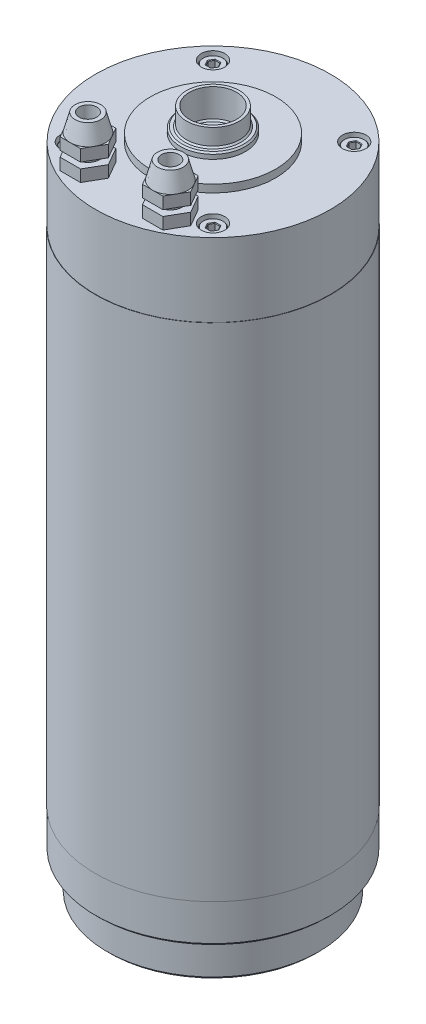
SolidWorks part; units mm, degrees
ref_plane "Ebene vorne" through (0, 0, 0) normal (0, 0, 1) x (1, 0, 0)
ref_plane "Ebene oben" through (0, 0, 0) normal (0, 1, 0) x (1, 0, 0)
ref_plane "Ebene rechts" through (0, 0, 0) normal (1, 0, 0) x (0, 0, -1)
sketch "Skizze1" plane through (0, 0, 0) normal (0, 0, 1) x (1, 0, 0)
  line L0 (-15, 0) -> (0, 0) construction
  line L1 (-15, 0) -> (-35, 0)
  line L2 (0, 30) -> (0, 224)
  line L3 (0, 224) -> (-21.3, 224)
  line L4 (-40, 26) -> (-40, 196.4)
  line L5 (0, 0) -> (0, 30) construction
  line L6 (-21.3, 224) -> (-21.3, 221.4)
  line L7 (-21.3, 221.4) -> (-39.9, 221.4)
  line L8 (-15, 0) -> (-15, 30)
  line L9 (-40, 196.4) -> (-39.9, 196.4)
  line L10 (-39.9, 221.4) -> (-39.9, 196.4)
  line L11 (-40, 26) -> (-39.9, 26)
  line L12 (-39.9, 13.6) -> (-39.9, 26)
  line L13 (-38.9, 12.6) -> (-36, 12.6)
  line L14 (-36, 1) -> (-36, 12.6)
  line L15 (-15, 30) -> (0, 30)
  line L16 (-39.9, 13.6) -> (-38.9, 12.6)
  line L17 (-35, 0) -> (-36, 1)
  point P12 (-39.9, 12.6)
  point P13 (-36, 0)
  dimension "D2" = 2.6
  dimension "D3" = 21.3
  dimension "D4" = 40
  dimension "D5" = 25
  dimension "D6" = 39.9
  dimension "D7" = 26
  dimension "D8" = 39.9
  dimension "D9" = 12.6
  dimension "D10" = 36
  dimension "D11" = 15
  dimension "D12" = 30
  dimension "D13" = 224
revolve "Rotation1" add sketch "Skizze1" angle 360 about L2
sketch "Skizze2" plane through (0, 221.4, 0) normal (0, 1, 0) x (1, 0, 0)
  line L1 (24, -24) -> (-24, -24) construction
  line L2 (24, -24) -> (24, 24) construction
  line L3 (24, 24) -> (-24, 24) construction
  line L4 (-24, -24) -> (-24, 24) construction
  circle A0 centre (24, -24) radius 4
  circle A1 centre (-24, -24) radius 4
  circle A2 centre (-24, 24) radius 4
  circle A3 centre (24, 24) radius 4
  dimension "D5" = 8
  dimension "D6" = 8
  dimension "D7" = 8
  dimension "D8" = 8
  dimension "D1" = 48
  dimension "D2" = 48
  dimension "D3" = 24
  dimension "D4" = 24
extrude "Schnitt-Linear austragen1" cut sketch "Skizze2" against normal blind 6
sketch "Skizze3" plane through (0, 215.4, 0) normal (0, 1, 0) x (1, 0, 0)
  line L0 (24, -24) -> (22.2679, -24) construction
  line L1 (22.2679, -24) -> (23.134, -25.5)
  line L2 (23.134, -25.5) -> (24.866, -25.5)
  line L3 (24.866, -25.5) -> (25.7321, -24)
  line L4 (25.7321, -24) -> (24.866, -22.5)
  line L5 (24.866, -22.5) -> (23.134, -22.5)
  line L6 (23.134, -22.5) -> (22.2679, -24)
  line L7 (-25.7321, -24) -> (-24.866, -25.5)
  line L8 (-24.866, -25.5) -> (-23.134, -25.5)
  line L9 (-23.134, -25.5) -> (-22.2679, -24)
  line L10 (-22.2679, -24) -> (-23.134, -22.5)
  line L11 (-23.134, -22.5) -> (-24.866, -22.5)
  line L12 (-24.866, -22.5) -> (-25.7321, -24)
  line L13 (-25.7321, 24) -> (-24.866, 22.5)
  line L14 (-24.866, 22.5) -> (-23.134, 22.5)
  line L15 (-23.134, 22.5) -> (-22.2679, 24)
  line L16 (-22.2679, 24) -> (-23.134, 25.5)
  line L17 (-23.134, 25.5) -> (-24.866, 25.5)
  line L18 (-24.866, 25.5) -> (-25.7321, 24)
  line L19 (22.2679, 24) -> (23.134, 22.5)
  line L20 (23.134, 22.5) -> (24.866, 22.5)
  line L21 (24.866, 22.5) -> (25.7321, 24)
  line L22 (25.7321, 24) -> (24.866, 25.5)
  line L23 (24.866, 25.5) -> (23.134, 25.5)
  line L24 (23.134, 25.5) -> (22.2679, 24)
  circle A0 centre (24, -24) radius 3.5
  circle A1 centre (24, -24) radius 1.5 construction
  circle A2 centre (-24, -24) radius 1.5 construction
  circle A3 centre (-24, -24) radius 3.5
  circle A4 centre (-24, 24) radius 1.5 construction
  circle A5 centre (-24, 24) radius 3.5
  circle A6 centre (24, 24) radius 1.5 construction
  circle A7 centre (24, 24) radius 3.5
  dimension "D1" = 7
  dimension "D2" = 3
  dimension "D3" = 2
  dimension "D4" = 2
extrude "Aufsatz-Linear austragen1" add sketch "Skizze3" along normal blind 5
chamfer "Fase1" distance 0.2 angle 45 7 edges at (24, 220.4, 25.5) (25.299, 220.4, 24.75) (25.299, 220.4, 23.25) (24, 220.4, 22.5) (22.701, 220.4, 23.25) (22.701, 220.4, 24.75) (20.5, 220.4, 24)
chamfer "Fase2" distance 0.2 angle 45 7 edges at (-24, 220.4, 25.5) (-22.701, 220.4, 24.75) (-22.701, 220.4, 23.25) (-24, 220.4, 22.5) (-25.299, 220.4, 23.25) (-25.299, 220.4, 24.75) (-27.5, 220.4, 24)
chamfer "Fase3" distance 0.2 angle 45 7 edges at (-24, 220.4, -22.5) (-22.701, 220.4, -23.25) (-22.701, 220.4, -24.75) (-24, 220.4, -25.5) (-25.299, 220.4, -24.75) (-25.299, 220.4, -23.25) (-27.5, 220.4, -24)
chamfer "Fase4" distance 0.2 angle 45 7 edges at (24, 220.4, -22.5) (25.299, 220.4, -23.25) (25.299, 220.4, -24.75) (24, 220.4, -25.5) (22.701, 220.4, -24.75) (22.701, 220.4, -23.25) (20.5, 220.4, -24)
sketch "Skizze5" plane through (0, 224, 0) normal (0, 1, 0) x (1, 0, 0)
  circle A0 centre (0, 0) radius 11
  dimension "D1" = 22
extrude "Aufsatz-Linear austragen2" add sketch "Skizze5" along normal blind 8
sketch "Skizze6" plane through (0, 232, 0) normal (0, 1, 0) x (1, 0, 0)
  circle A0 centre (0, 0) radius 9
  circle A1 centre (0, 0) radius 14.4788
  dimension "D1" = 18
extrude "Schnitt-Linear austragen2" cut sketch "Skizze6" against normal blind 6
sketch "Skizze7" plane through (0, 232, 0) normal (0, 1, 0) x (1, 0, 0)
  circle A0 centre (0, 0) radius 8
  dimension "D1" = 16
extrude "Schnitt-Linear austragen3" cut sketch "Skizze7" against normal blind 10
chamfer "Fase5" distance 0.5 angle 45 3 edges at (-8, 222, 0) (-9, 226, 0) (-11, 226, 0)
sketch "Skizze8" plane through (0, 221.4, 0) normal (0, 1, 0) x (1, 0, 0)
  line L0 (14, -28.5) -> (-14, -28.5) construction
  line L2 (10.5359, -22.5) -> (7.0718, -28.5)
  line L3 (7.0718, -28.5) -> (10.5359, -34.5)
  line L4 (10.5359, -34.5) -> (17.4641, -34.5)
  line L5 (17.4641, -34.5) -> (20.9282, -28.5)
  line L6 (20.9282, -28.5) -> (17.4641, -22.5)
  line L7 (17.4641, -22.5) -> (10.5359, -22.5)
  line L8 (-10.5359, -22.5) -> (-17.4641, -22.5)
  line L9 (-17.4641, -22.5) -> (-20.9282, -28.5)
  line L10 (-20.9282, -28.5) -> (-17.4641, -34.5)
  line L11 (-17.4641, -34.5) -> (-10.5359, -34.5)
  line L12 (-10.5359, -34.5) -> (-7.0718, -28.5)
  line L13 (-7.0718, -28.5) -> (-10.5359, -22.5)
  circle A0 centre (14, -28.5) radius 6 construction
  circle A1 centre (-14, -28.5) radius 6 construction
  circle A2 centre (0, 0) radius 39.9 construction
  dimension "D1" = 28
  dimension "D2" = 14
  dimension "D3" = 12
  dimension "D4" = 12
  dimension "D5" = 28.5
extrude "Aufsatz-Linear austragen3" add sketch "Skizze8" along normal blind 4
sketch "Skizze9" plane through (0, 225.4, 0) normal (0, 1, 0) x (1, 0, 0)
  line L0 (20.9282, -28.5) -> (-20.9282, -28.5) construction
  line L1 (-14, -34.5) -> (-14, -22.5) construction
  line L2 (-17.4641, -34.5) -> (-10.5359, -34.5) construction
  line L3 (-10.5359, -22.5) -> (-17.4641, -22.5) construction
  line L4 (14, -34.5) -> (14, -22.5) construction
  line L5 (10.5359, -34.5) -> (17.4641, -34.5) construction
  line L6 (17.4641, -22.5) -> (10.5359, -22.5) construction
  circle A0 centre (14, -28.5) radius 4
  circle A1 centre (-14, -28.5) radius 4
  dimension "D1" = 8
  dimension "D2" = 8
extrude "Aufsatz-Linear austragen4" add sketch "Skizze9" along normal blind 2
sketch "Skizze10" plane through (0, 227.4, 0) normal (0, 1, 0) x (1, 0, 0)
  line L0 (10.5359, -22.5) -> (7.0718, -28.5) construction
  line L1 (7.0718, -28.5) -> (10.5359, -34.5)
  line L2 (10.5359, -34.5) -> (17.4641, -34.5)
  line L3 (17.4641, -34.5) -> (20.9282, -28.5)
  line L4 (20.9282, -28.5) -> (17.4641, -22.5)
  line L5 (17.4641, -22.5) -> (10.5359, -22.5)
  line L6 (10.5359, -22.5) -> (7.0718, -28.5)
  line L7 (-20.9282, -28.5) -> (-17.4641, -34.5)
  line L8 (-17.4641, -34.5) -> (-10.5359, -34.5)
  line L9 (-10.5359, -34.5) -> (-7.0718, -28.5)
  line L10 (-7.0718, -28.5) -> (-10.5359, -22.5)
  line L11 (-10.5359, -22.5) -> (-17.4641, -22.5)
  line L12 (-17.4641, -22.5) -> (-20.9282, -28.5)
  line L13 (10.5359, -22.5) -> (7.0718, -28.5) construction
  line L14 (20.9282, -28.5) -> (17.4641, -22.5) construction
  line L15 (20.9282, -28.5) -> (17.4641, -22.5) construction
  circle A0 centre (14, -28.5) radius 6 construction
  circle A1 centre (-14, -28.5) radius 6 construction
extrude "Aufsatz-Linear austragen5" add sketch "Skizze10" along normal blind 4
sketch "Skizze12" plane through (0, 231.4, 0) normal (0, 1, 0) x (1, 0, 0)
  line L0 (14, -34.5) -> (14, -22.5) construction
  line L1 (10.5359, -34.5) -> (17.4641, -34.5) construction
  line L2 (17.4641, -22.5) -> (10.5359, -22.5) construction
  line L3 (-14, -34.5) -> (-14, -22.5) construction
  line L4 (-17.4641, -34.5) -> (-10.5359, -34.5) construction
  line L5 (-10.5359, -22.5) -> (-17.4641, -22.5) construction
  line L6 (14, -28.5) -> (-14, -28.5) construction
  circle A0 centre (14, -28.5) radius 6
  circle A1 centre (-14, -28.5) radius 6
  dimension "D1" = 12
  dimension "D2" = 12
extrude "Aufsatz-Linear austragen6" add sketch "Skizze12" along normal blind 6 draft 15
sketch "Skizze13" plane through (0, 237.4, 0) normal (0, 1, 0) x (1, 0, 0)
  circle A0 centre (14, -28.5) radius 3
  circle A1 centre (-14, -28.5) radius 3
  dimension "D1" = 6
  dimension "D2" = 6
extrude "Schnitt-Linear austragen4" cut sketch "Skizze13" against normal blind 16
